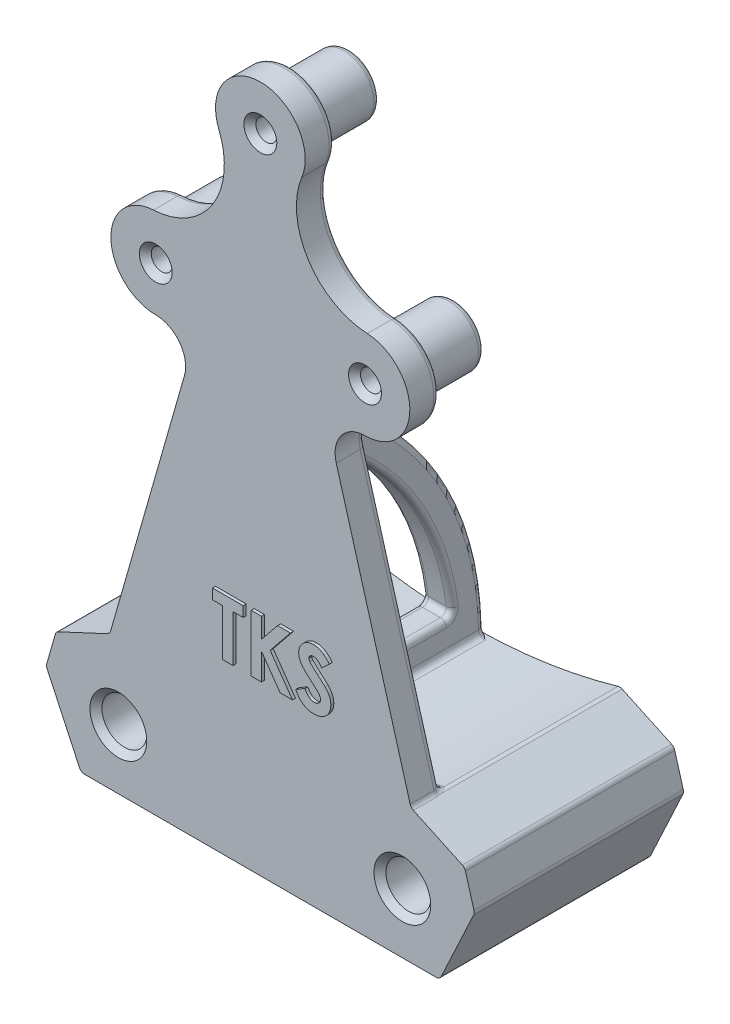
SolidWorks part; units mm, degrees
ref_plane "Front Plane" through (0, 0, 0) normal (0, 0, 1) x (1, 0, 0)
ref_plane "Top Plane" through (0, 0, 0) normal (0, 1, 0) x (1, 0, 0)
ref_plane "Right Plane" through (0, 0, 0) normal (1, 0, 0) x (0, 0, -1)
sketch "Sketch1" plane through (0, 0, 0) normal (0, 0, 1) x (1, 0, 0)
  line L0 (60, 0) -> (-60, 0)
  line L1 (-25.3854, 132.2505) -> (-50.3563, 44.9319)
  line L2 (-50.3563, 44.9319) -> (-68.3583, 36.5375)
  line L3 (-68.3583, 36.5375) -> (-71.6577, 25)
  line L4 (-71.6577, 25) -> (-60, 0)
  line L5 (0, 110) -> (0, 0) construction
  line L6 (71.6577, 25) -> (60, 0)
  line L7 (68.3583, 36.5375) -> (71.6577, 25)
  line L8 (50.3563, 44.9319) -> (68.3583, 36.5375)
  line L9 (25.3854, 132.2505) -> (50.3563, 44.9319)
  arc A0 (35, 145) -> (25.3854, 132.2505) centre (35, 135) ccw
  arc A1 (35, 145) -> (35.7723, 174.9801) centre (35, 160) ccw
  arc A2 (13.8973, 209.3551) -> (35.7723, 174.9801) centre (37.0595, 199.9469) ccw
  arc A3 (13.8973, 209.3551) -> (-13.8973, 209.3551) centre (0, 215) ccw
  arc A4 (-13.8973, 209.3551) -> (-35.7723, 174.9801) centre (-37.0595, 199.9469) cw
  arc A5 (-35, 145) -> (-35.7723, 174.9801) centre (-35, 160) cw
  arc A6 (-35, 145) -> (-25.3854, 132.2505) centre (-35, 135) cw
  point P5 (0, 0)
  dimension "D4" = 12
  dimension "D5" = 160
  dimension "D8" = 15
  dimension "D11" = 25
  dimension "D12" = 10
  dimension "D2" = 25
  dimension "D3" = 115
  dimension "D6" = 15
  dimension "D7" = 120
  dimension "D9" = 215
  dimension "D10" = 70
extrude "Boss-Extrude1" add sketch "Sketch1" against normal blind 10
sketch "Sketch3" plane through (0, 0, -10) normal (0, 0, -1) x (-1, 0, 0)
  line L0 (50.3563, 44.9319) -> (68.3583, 36.5375) construction
  line L1 (68.3583, 36.5375) -> (71.6577, 25) construction
  line L2 (71.6577, 25) -> (60, 0) construction
  line L3 (60, 0) -> (-60, 0) construction
  line L4 (-60, 0) -> (-71.6577, 25) construction
  line L5 (-71.6577, 25) -> (-68.3583, 36.5375) construction
  line L6 (-68.3583, 36.5375) -> (-50.3563, 44.9319) construction
  line L7 (50.3563, 44.9319) -> (68.3583, 36.5375)
  line L8 (68.3583, 36.5375) -> (71.6577, 25)
  line L9 (71.6577, 25) -> (60, 0)
  line L10 (60, 0) -> (-60, 0)
  line L11 (-60, 0) -> (-71.6577, 25)
  line L12 (-71.6577, 25) -> (-68.3583, 36.5375)
  line L13 (-68.3583, 36.5375) -> (-50.3563, 44.9319)
  arc A0 (-50.3563, 44.9319) -> (50.3563, 44.9319) centre (0, 215) ccw
  arc A2 (13.8973, 209.3551) -> (-13.8973, 209.3551) centre (0, 215) ccw construction
extrude "Boss-Extrude2" add sketch "Sketch3" along normal blind 60
sketch "Sketch4" plane through (0, 0, -10) normal (0, 0, -1) x (-1, 0, 0)
  circle A0 centre (0, 215) radius 10
  circle A2 centre (35, 160) radius 10
  circle A3 centre (-35, 160) radius 10
  arc A4 (-35.7723, 174.9801) -> (-35, 145) centre (-35, 160) ccw construction
  arc A5 (13.8973, 209.3551) -> (-13.8973, 209.3551) centre (0, 215) ccw construction
  dimension "D1" = 20
extrude "Boss-Extrude3" add sketch "Sketch4" along normal blind 20
sketch "Sketch6" plane through (0, 0, 0) normal (0, 0, 1) x (1, 0, 0)
  line L0 (0, 0) -> (0, 80.1009) construction
  line L1 (-60, 0) -> (60, 0) construction
  circle A0 centre (0, 215) radius 3.5
  circle A1 centre (-47.5, 20) radius 7.5
  circle A2 centre (47.5, 20) radius 7.5
  circle A3 centre (-35, 160) radius 3.5
  circle A4 centre (35, 160) radius 3.5
  arc A5 (13.8973, 209.3551) -> (-13.8973, 209.3551) centre (0, 215) ccw construction
  dimension "D1" = 7
  dimension "D2" = 15
  dimension "D3" = 95
  dimension "D4" = 20
extrude "Cut-Extrude1" cut sketch "Sketch6" against normal through all
sketch "Sketch8" plane through (0, 0, 0) normal (1, 0, 0) x (0, 0, -1)
  line L0 (70, 25) -> (70, 0) construction
  line L2 (10, 37.6334) -> (70, 37.6334) construction
  line L3 (10, 37.6334) -> (10, 132.2505)
  line L4 (10, 37.6334) -> (70, 37.6334)
  arc A0 (10, 132.2505) -> (70, 37.6334) centre (-34.6033, 37.6334) cw
extrude "Boss-Extrude4" add sketch "Sketch8" along normal mid plane 10
sketch "Sketch9" plane through (-5, 0, 0) normal (-1, 0, 0) x (0, 0, 1)
  line L4 (-59.4625, 47.7039) -> (-20, 47.7039)
  line L5 (-59.4625, 47.7039) -> (-20, 47.7039)
  line L6 (-20, 47.7039) -> (-20, 114.8879)
  line L7 (-20, 47.7039) -> (-20, 114.8879)
  arc A2 (-20, 114.8879) -> (-59.4625, 47.7039) centre (34.6033, 37.6334) ccw
  arc A3 (-20, 114.8879) -> (-59.4625, 47.7039) centre (34.6033, 37.6334) ccw
  dimension "D1" = 10
extrude "Cut-Extrude2" cut sketch "Sketch9" against normal through all
chamfer "Chamfer1" distance 2 angle 45 10 edges at (-40, 20, 0) (55, 20, 0) (38.5, 160, 0) (3.5, 215, 0) (-31.5, 160, 0) (-38.5, 160, -30) (31.5, 160, -30) (-3.5, 215, -30) (-40, 20, -70) (55, 20, -70)
fillet "Fillet8" radius 2 6 edges at (-25, 160, -10) (45, 160, -10) (10, 215, -10) (-45, 160, -30) (-10, 215, -30) (25, 160, -30)
fillet "Fillet23" radius 2 9 edges at (37.8709, 88.5912, -10) (27.0158, 141.021, -10) (49.995, 159.6137, -10) (15.9679, 186.5251, -10) (0, 230, -10) (-15.9679, 186.5251, -10) (-49.995, 159.6137, -10) (-27.0158, 141.021, -10) (-37.8709, 88.5912, -10)
fillet "Fillet25" radius 2 1 edges at (-50.3563, 44.9319, -39)
fillet "Fillet28" radius 2 2 edges at (-5, 84.9772, -10) (-5, 37.7039, -40)
fillet "Fillet29" radius 2 5 edges at (-50.3969, 44.79, -4) (-50.0683, 44.7961, -9.0762) (-48.8577, 44.4953, -9.9512) (-5.5858, 38.3589, -10.5858) (-27.9531, 39.85, -10)
fillet "Fillet34" radius 2 1 edges at (50.3563, 44.9319, -39)
fillet "Fillet35" radius 2 6 edges at (50.3969, 44.79, -4) (50.2829, 44.7982, -8.6466) (49.0719, 44.5569, -9.8873) (5, 84.9772, -10) (5, 37.7039, -40) (26.9251, 39.689, -10)
fillet "Fillet36" radius 2 7 edges at (-5.814, 38.1628, -69.9987) (-5.5355, 131.9471, -10.638) (5.4382, 38.5239, -69.9962) (5.8408, 132.0751, -10.3702) (-5, 93.6173, -53.7576) (5, 93.6173, -53.7576) (0, 132.2505, -10)
fillet "Fillet37" radius 2 9 edges at (5, 85.5472, -46.969) (-5, 85.5472, -46.969) (5, 47.7039, -39.7312) (-5, 47.7039, -39.7312) (0, 47.7039, -59.4625) (5, 81.2959, -20) (0, 114.8879, -20) (-5, 81.2959, -20) (0, 47.7039, -20)
fillet "Fillet38" radius 2 6 edges at (68.3583, 36.5375, -35) (71.6577, 25, -35) (60, 0, -35) (-60, 0, -35) (-71.6577, 25, -35) (-68.3583, 36.5375, -35)
sketch "Sketch11" plane through (0, 0, 0) normal (0, 0, 1) x (1, 0, 0)
  text T0 "TKS" font "Century Gothic" height in points 72
extrude "Boss-Extrude6" add sketch "Sketch11" along normal blind 1
